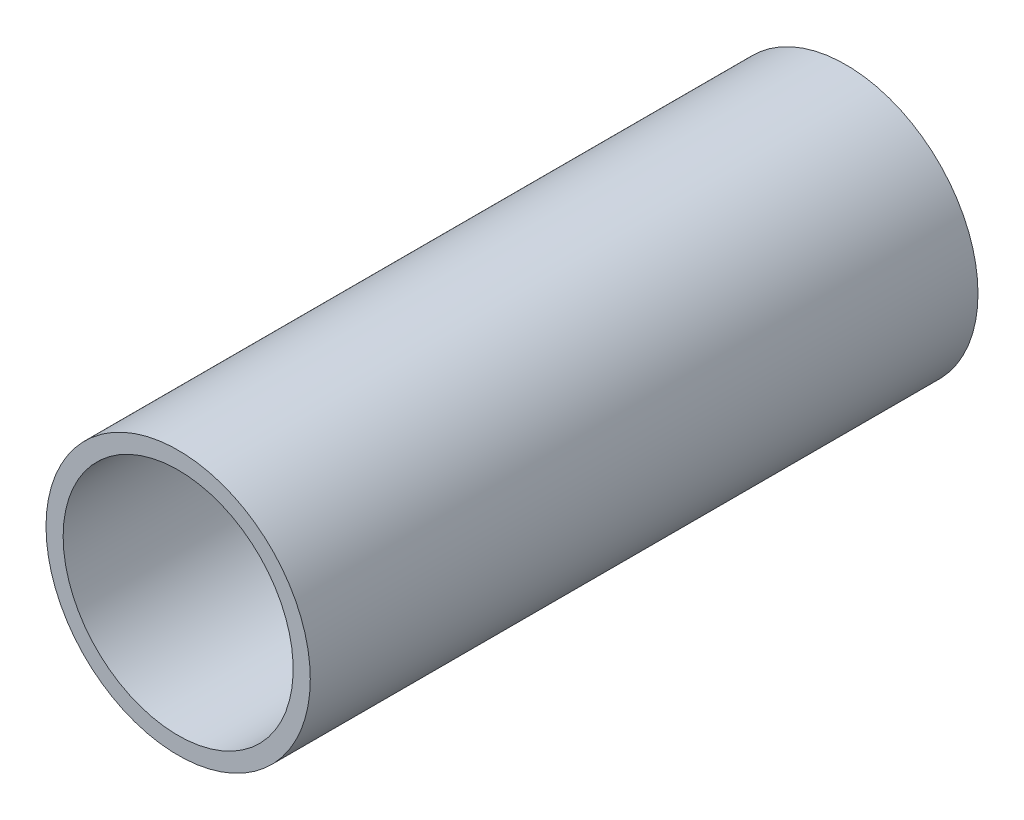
SolidWorks part; units mm, degrees
ref_plane "Front Plane" through (0, 0, 0) normal (0, 0, 1) x (1, 0, 0)
ref_plane "Top Plane" through (0, 0, 0) normal (0, 1, 0) x (1, 0, 0)
ref_plane "Right Plane" through (0, 0, 0) normal (1, 0, 0) x (0, 0, -1)
sketch "Sketch1" plane through (0, 0, 0) normal (0, 0, 1) x (1, 0, 0)
  circle A0 centre (0, 0) radius 30.1625
  dimension "Pipe OD" = 60.325
extrude "Extrude-Thin1" add sketch "Sketch1" along normal mid plane 152.4 thin
